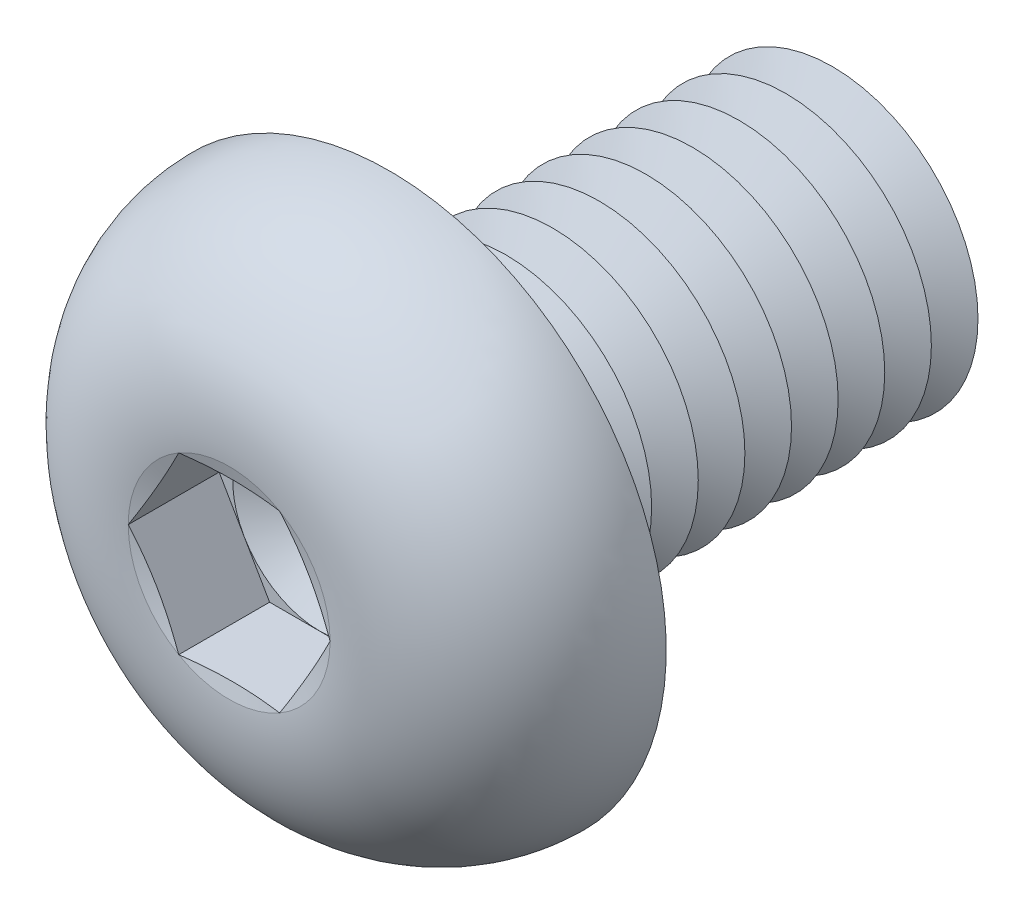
SolidWorks part; units mm, degrees
ref_plane "Front Plane" through (0, 0, 0) normal (0, 0, 1) x (1, 0, 0)
ref_plane "Top Plane" through (0, 0, 0) normal (0, 1, 0) x (1, 0, 0)
ref_plane "Right Plane" through (0, 0, 0) normal (1, 0, 0) x (0, 0, -1)
sketch "Sketch1" plane through (0, 0, 0) normal (1, 0, 0) x (0, 0, -1)
  line L0 (0, 2.5) -> (0, 4.75)
  line L3 (0, 2.5) -> (8, 2.5)
  line L4 (8, 2.5) -> (8, 0)
  line L5 (8, 0) -> (-2.75, 0) construction
  line L6 (-2.75, 0) -> (8, 0)
  line L7 (-2.75, 1.732) -> (-2.75, 0.866) construction
  line L8 (-2.75, 0.866) -> (-2.75, 0)
  line L9 (-2.75, 1.732) -> (-2.5179, 0.866)
  line L10 (-2.5179, 0.866) -> (-2.75, 0.866)
  line L11 (8, 0) -> (22.7481, 0) construction
  line L12 (0, 4.75) -> (-2.75, 4.75) construction
  arc A1 (0, 4.75) -> (-2.75, 1.732) centre (0, 1.9881) ccw
  point P8 (8, 1.25)
  dimension "D1" = 9.5
  dimension "D2" = 5
  dimension "D3" = 2.75
  dimension "D4" = 3.4641
  dimension "D5" = 8
  dimension "D6" = 15
revolve "Revolve1" add sketch "Sketch1" angle 360 about L5
fillet "Fillet1" radius 0.4 1 edges at (-2.5, 0, 0)
sketch "Sketch2" plane through (0, 0, 0) normal (1, 0, 0) x (0, 0, -1)
  line L0 (7.6, 2.5) -> (8.4, 2.5)
  line L1 (8, 2.5) -> (0.4, 2.5) construction
  line L2 (8.4, 2.5) -> (8, 1.8072)
  line L3 (8, -2.5) -> (8, 2.5) construction
  line L4 (8, 1.8072) -> (7.6, 2.5)
  dimension "D1" = 0.8
revolve "Cut-Revolve1" cut sketch "Sketch2" angle 360 about axis through (0, 0, -8) along (0, 0, -1)
pattern_linear "LPattern1" count 10 spacing 0.8 along (0, 0, 1) of "Cut-Revolve1"
sketch "Sketch3" plane through (0, 0, 2.75) normal (0, 0, 1) x (1, 0, 0)
  line L7 (0.866, 1.5) -> (-0.866, 1.5)
  line L8 (-0.866, 1.5) -> (-1.7321, 0)
  line L9 (-1.7321, 0) -> (-0.866, -1.5)
  line L10 (-0.866, -1.5) -> (0.866, -1.5)
  line L11 (0.866, -1.5) -> (1.7321, 0)
  line L12 (1.7321, 0) -> (0.866, 1.5)
  circle A0 centre (0, 0) radius 1.5 construction
  circle A3 centre (0, 0) radius 1.732 construction
extrude "Cut-Extrude1" cut sketch "Sketch3" against normal blind 1.56
sketch "Sketch4" plane through (0, 0, 1.19) normal (0, 0, 1) x (1, 0, 0)
  line L1 (0.866, 1.5) -> (-0.866, 1.5) construction
  circle A0 centre (0, 0) radius 1.5
extrude "Cut-Extrude2" cut sketch "Sketch4" against normal through all draft 60
